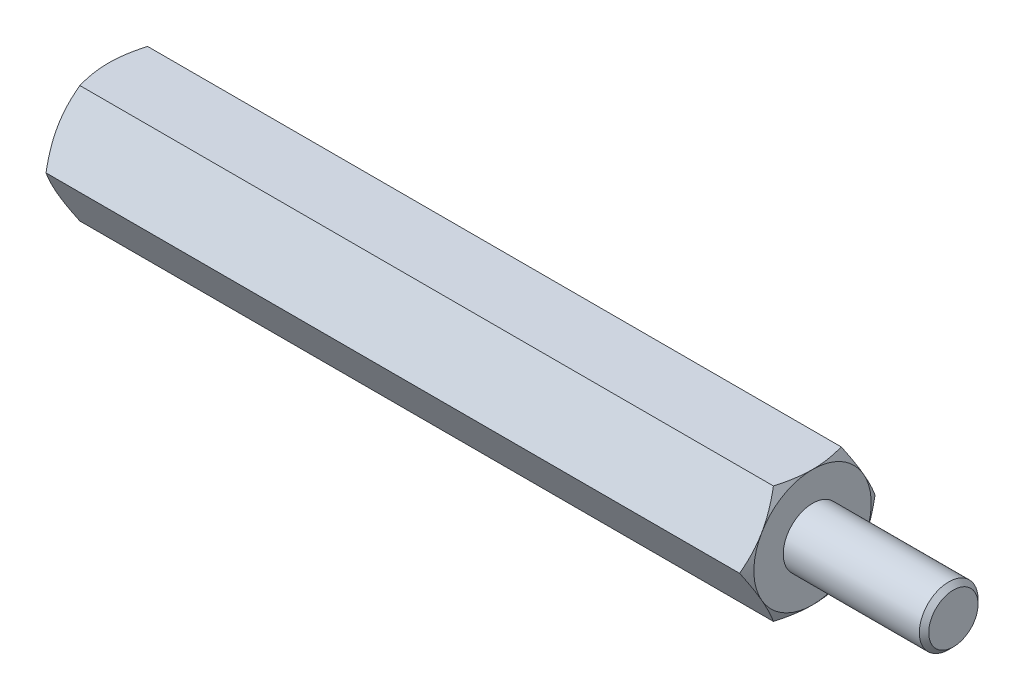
SolidWorks part; units mm, degrees
ref_plane "Front Plane" through (0, 0, 0) normal (0, 0, 1) x (1, 0, 0)
ref_plane "Top Plane" through (0, 0, 0) normal (0, 1, 0) x (1, 0, 0)
ref_plane "Right Plane" through (0, 0, 0) normal (1, 0, 0) x (0, 0, -1)
sketch "Sketch1" plane through (0, 0, 0) normal (1, 0, 0) x (0, 0, -1)
  line L1 (1.4434, 2.5) -> (-1.4434, 2.5)
  line L2 (-1.4434, 2.5) -> (-2.8868, 0)
  line L3 (-2.8868, 0) -> (-1.4434, -2.5)
  line L4 (-1.4434, -2.5) -> (1.4434, -2.5)
  line L5 (1.4434, -2.5) -> (2.8868, 0)
  line L6 (2.8868, 0) -> (1.4434, 2.5)
  circle A0 centre (0, 0) radius 2.5 construction
  dimension "D1" = 5
extrude "Extrude2" add sketch "Sketch1" along normal mid plane 30
sketch "Sketch2" plane through (0, 0, 0) normal (0, 0, 1) x (1, 0, 0)
  line L0 (-15, 2.5) -> (-13.5, 5.0981)
  line L1 (-15, 5.5) -> (-15, 2.5)
  line L3 (0, 0) -> (50000, 0) construction
  arc A0 (-13.5, 5.0981) -> (-15, 5.5) centre (-14.1962, 5.5) ccw
  dimension "D1" = 30
  dimension "D2" = 3
revolve "Cut-Revolve1" cut sketch "Sketch2" angle 360 about L3
mirror "Mirror1" about plane through (0, 0, 0) normal (1, 0, 0) of "Cut-Revolve1"
sketch "Sketch3" plane through (-15, 0, 0) normal (-1, 0, 0) x (0, 0, 1)
  circle A0 centre (0, 0) radius 1.05
  dimension "D1" = 2.1
extrude "Extrude3" cut sketch "Sketch3" against normal blind 6
sketch "Sketch4" plane through (0, 0, 0) normal (0, 0, 1) x (1, 0, 0)
  line L0 (-9, 0) -> (-9, 1.05)
  line L1 (14.7767, 0) -> (-14.7767, 0) construction
  line L2 (-9, 1.05) -> (-8.3938, 0)
  line L3 (-8.3938, 0) -> (-9, 0)
  line L4 (-15, 1.25) -> (-15, -1.25) construction
  point P4 (-15, 0)
  dimension "D1" = 30
  dimension "D2" = 1.05
  dimension "D3" = 6
revolve "Cut-Revolve2" cut sketch "Sketch4" angle 360 about L3
sketch "Sketch5" plane through (15, 0, 0) normal (1, 0, 0) x (0, 0, -1)
  circle A0 centre (0, 0) radius 1.25
  dimension "D1" = 2.5
extrude "Extrude4" add sketch "Sketch5" along normal blind 6
chamfer "Chamfer1" distance 0.2 angle 45 1 edges at (21, 0, -1.25)
equation "\"D2@Sketch4\" = \"D1@Sketch3\"/2"
